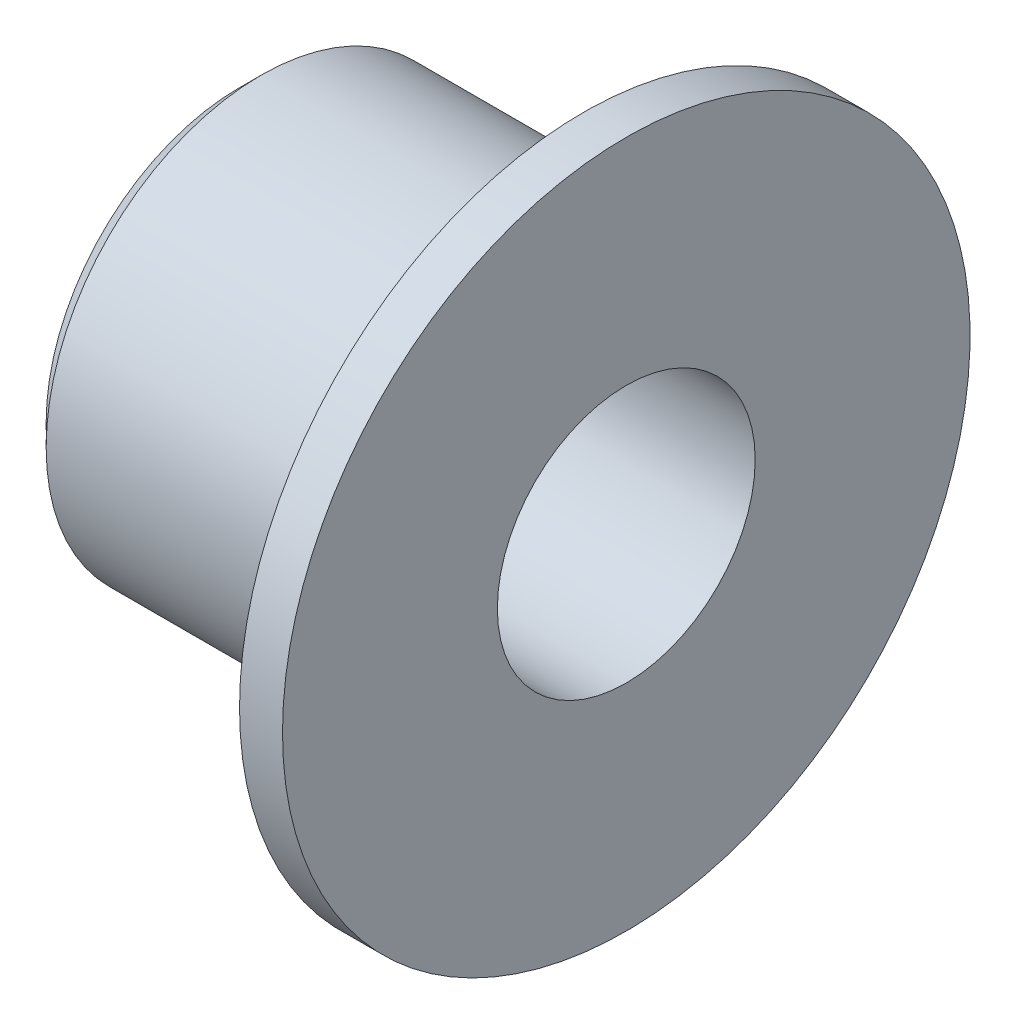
SolidWorks part; units mm, degrees
ref_plane "Plan de face" through (0, 0, 0) normal (0, 0, 1) x (1, 0, 0)
ref_plane "Plan de dessus" through (0, 0, 0) normal (0, 1, 0) x (1, 0, 0)
ref_plane "Plan de droite" through (0, 0, 0) normal (1, 0, 0) x (0, 0, -1)
sketch "Esquisse1" plane through (0, 0, 0) normal (0, 0, 1) x (1, 0, 0)
  line L0 (0, 0) -> (84.8814, 0) construction
  line L1 (0, 3) -> (0, 5)
  line L2 (0, 5) -> (8, 5)
  line L3 (8, 5) -> (8, 8)
  line L4 (8, 8) -> (9, 8)
  line L5 (9, 8) -> (9, 3)
  line L6 (9, 3) -> (0, 3)
  dimension "D1" = 3
  dimension "D2" = 5
  dimension "D3" = 8
  dimension "D4" = 8
  dimension "D5" = 1
revolve "Révolution1" add sketch "Esquisse1" angle 360 about L0
chamfer "Chanfrein1" distance 0.5 angle 45 1 edges at (0, 0, 5)
